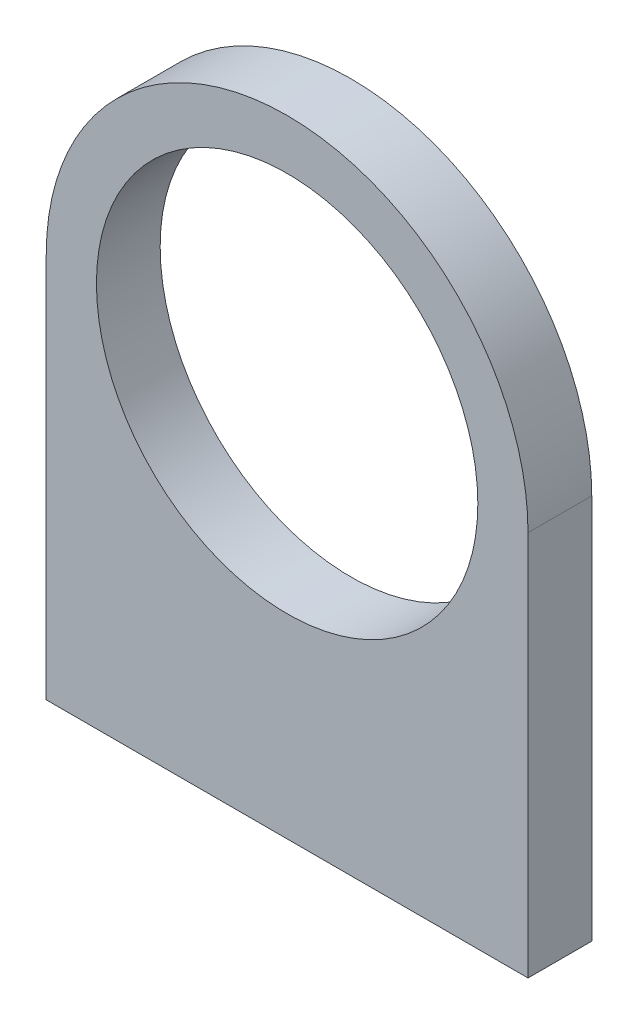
SolidWorks part; units mm, degrees
ref_plane "Front Plane" through (0, 0, 0) normal (0, 0, 1) x (1, 0, 0)
ref_plane "Top Plane" through (0, 0, 0) normal (0, 1, 0) x (1, 0, 0)
ref_plane "Right Plane" through (0, 0, 0) normal (1, 0, 0) x (0, 0, -1)
sketch "Sketch1" plane through (0, 0, 0) normal (0, 0, 1) x (1, 0, 0)
  line L0 (0, 0) -> (48, 0)
  line L1 (48, 0) -> (48, 38.425)
  line L2 (0, 0) -> (0, 38.425)
  line L3 (0, 38.425) -> (48, 38.425) construction
  circle A0 centre (24, 38.425) radius 19
  arc A1 (0, 38.425) -> (48, 38.425) centre (24, 38.425) cw
  dimension "D1" = 38
  dimension "D3" = 5
  dimension "D2" = 38.425
extrude "Boss-Extrude1" add sketch "Sketch1" along normal blind 6.35
